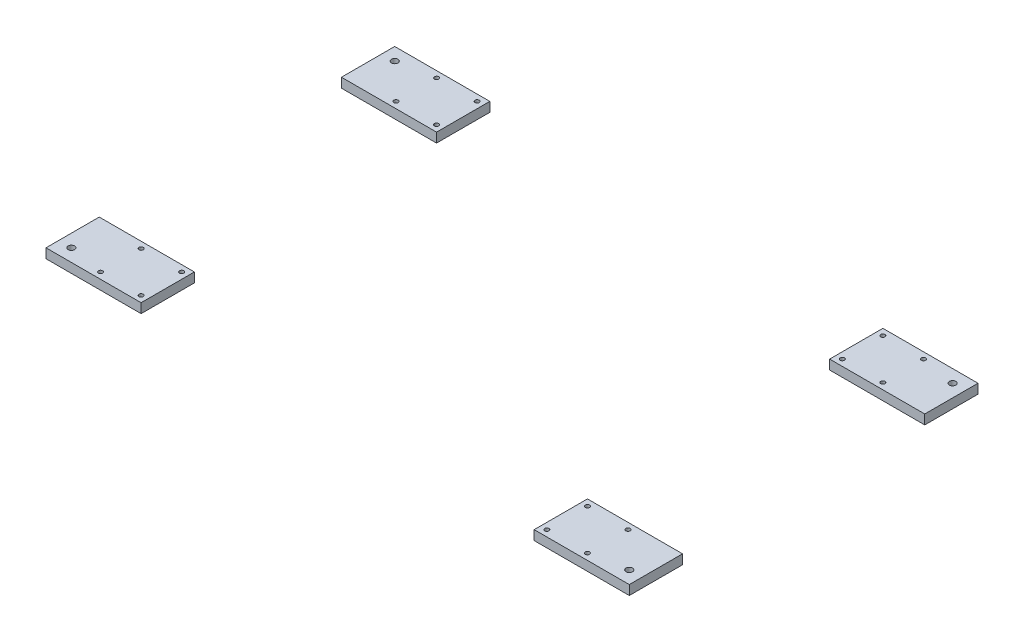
SolidWorks part; units mm, degrees
ref_plane "前视基准面" through (0, 0, 0) normal (0, 0, 1) x (1, 0, 0)
ref_plane "上视基准面" through (0, 0, 0) normal (0, 1, 0) x (1, 0, 0)
ref_plane "右视基准面" through (0, 0, 0) normal (1, 0, 0) x (0, 0, -1)
sketch "草图1" plane through (0, 0, 0) normal (0, 0, 1) x (1, 0, 0)
  line L0 (150, 15) -> (0, 15)
  line L1 (150, 0) -> (0, 0)
  line L2 (0, 0) -> (0, 15)
  line L3 (150, 0) -> (150, 15)
  line L4 (770, 15) -> (920, 15)
  line L5 (770, 0) -> (920, 0)
  line L6 (920, 0) -> (920, 15)
  line L7 (770, 0) -> (770, 15)
extrude "凸台-拉伸1" add sketch "草图1" along normal blind 550
sketch "草图2" plane through (0, 15, 0) normal (0, 1, 0) x (1, 0, 0)
  line L0 (0, -550) -> (0, -466)
  line L1 (150, -550) -> (150, -466)
  line L2 (150, -550) -> (0, -550)
  line L3 (150, -466) -> (0, -466)
  line L4 (0, 0) -> (0, -84)
  line L5 (150, 0) -> (150, -84)
  line L6 (150, 0) -> (0, 0)
  line L7 (150, -84) -> (0, -84)
  line L8 (920, -550) -> (920, -466)
  line L9 (770, -550) -> (770, -466)
  line L10 (770, -550) -> (920, -550)
  line L11 (770, -466) -> (920, -466)
  line L12 (920, 0) -> (920, -84)
  line L13 (770, 0) -> (770, -84)
  line L14 (770, 0) -> (920, 0)
  line L15 (770, -84) -> (920, -84)
  circle A0 centre (140, -540) radius 3.375
  circle A1 centre (140, -476) radius 3.375
  circle A2 centre (76, -476) radius 3.375
  circle A3 centre (76, -540) radius 3.375
  circle A4 centre (20, -530) radius 5.125
  circle A5 centre (140, -10) radius 3.375
  circle A6 centre (140, -74) radius 3.375
  circle A7 centre (76, -74) radius 3.375
  circle A8 centre (76, -10) radius 3.375
  circle A9 centre (20, -20) radius 5.125
  circle A10 centre (780, -540) radius 3.375
  circle A11 centre (780, -476) radius 3.375
  circle A12 centre (844, -476) radius 3.375
  circle A13 centre (844, -540) radius 3.375
  circle A14 centre (900, -530) radius 5.125
  circle A15 centre (780, -10) radius 3.375
  circle A16 centre (780, -74) radius 3.375
  circle A17 centre (844, -74) radius 3.375
  circle A18 centre (844, -10) radius 3.375
  circle A19 centre (900, -20) radius 5.125
extrude "切除-拉伸1" cut sketch "草图2" against normal blind 550 flip side to cut
